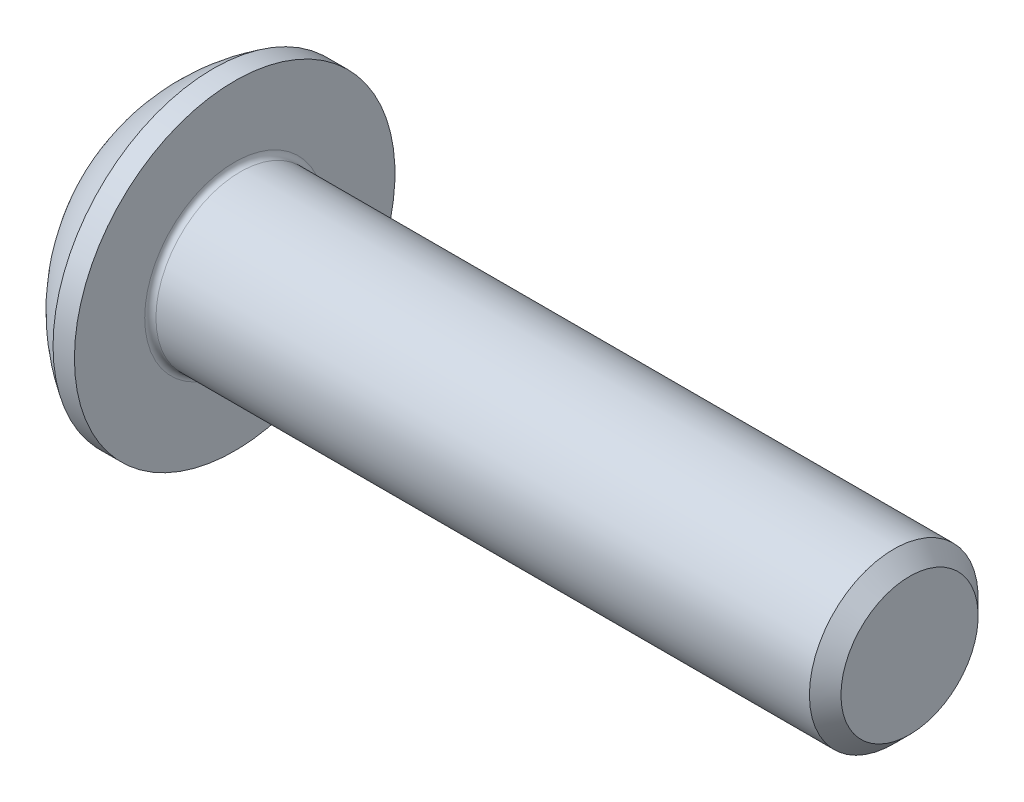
SolidWorks part; units mm, degrees
ref_plane "Plane1" through (0, 0, 0) normal (0, 0, 1) x (1, 0, 0)
ref_plane "Plane2" through (0, 0, 0) normal (0, 1, 0) x (1, 0, 0)
ref_plane "Plane3" through (0, 0, 0) normal (1, 0, 0) x (0, 0, -1)
other "Configuration Table"
sketch "BodySke" plane through (0, 0, 0) normal (0, 0, 1) x (1, 0, 0)
  line L0 (13.65, 0) -> (13.65, 1.2195)
  line L1 (13.3695, 1.5) -> (1.65, 1.5)
  line L2 (1.65, 1.5) -> (1.65, 2.85)
  line L3 (1.65, 2.85) -> (1.27, 2.85)
  line L4 (0, 0) -> (101.6, 0) construction
  line L5 (1.65, -2.85) -> (1.27, -2.85) construction
  line L6 (55.6768, -1.5) -> (1.65, -1.5) construction
  line L7 (13.65, 0) -> (0, 0)
  line L8 (0, 1.425) -> (0, -1.425) construction
  line L9 (0, 0) -> (0, 1.425)
  line L10 (13.65, 1.2195) -> (13.3695, 1.5)
  line L11 (13.65, -1.2195) -> (13.3695, -1.5) construction
  line L12 (2.15, 9.525) -> (2.15, -1.5) construction
  line L13 (1.65, 9.525) -> (1.65, -1.5) construction
  arc A1 (0, 1.425) -> (1.27, 2.85) centre (3.0334, 0) cw
revolve "BaseBody" add sketch "BodySke" angle 360 about L4
fillet "Fillet1" radius 0.1 1 edges at (1.65, 0, 1.5)
sketch "Sketch2" plane through (0, 0, 0) normal (0, 0, 1) x (1, 0, 0)
  line L0 (0, 1) -> (1.04, 1)
  line L1 (1.04, 1) -> (1.6174, 0)
  line L3 (1.6174, 0) -> (0, 0)
  line L4 (0, 0) -> (0, 1)
  line L5 (0, -1) -> (1.04, -1) construction
  line L6 (0, 0) -> (47.625, 0) construction
  dimension "D2" = 60
  dimension "PreBroach_depth" = 1.04
  dimension "PreBroach_dia" = 2
revolve "PreBroach" cut sketch "Sketch2" angle 360 about L6
sketch "Sketch3" plane through (0, 0, 0) normal (1, 0, 0) x (0, 0, -1)
  line L0 (-1, -0.5774) -> (-1, 0.5774)
  line L1 (-1, 0.5774) -> (0, 1.1547)
  line L2 (0, 1.1547) -> (1, 0.5774)
  line L3 (1, 0.5774) -> (1, -0.5774)
  line L4 (1, -0.5774) -> (0, -1.1547)
  line L5 (0, -1.1547) -> (-1, -0.5774)
extrude "Hex" cut sketch "Sketch3" along normal blind 1.04
sketch "ThdSchSke" plane through (0, 0, 0) normal (0, 0, 1) x (1, 0, 0)
  line L0 (2.65, -1.2195) -> (2.4536, -1.5)
  line L1 (2.65, -1.2195) -> (2.8464, -1.5)
  line L2 (2.8464, -1.5) -> (2.8464, -1.875)
  line L3 (-3.175, 0) -> (5.1513, 0) construction
  line L5 (2.8464, -1.875) -> (2.4536, -1.875)
  line L6 (2.4536, -1.875) -> (2.4536, -1.5)
revolve "ThreadSchematic" [suppressed] cut sketch "ThdSchSke" angle 360 about L3
pattern_linear "ThdSchPat" [suppressed]
equation "\"D1@BodySke\" = \"Head_dia@BodySke\" * .5"
equation "\"Thread_minor@ThreadCosmetic\" = \"Minor_dia@BodySke\""
equation "\"D1@Sketch3\" = \"Hex_size@Sketch3\" / 2"
equation "\"D2@Sketch3\" = \"D1@Sketch3\""
equation "\"D3@Sketch3\" = \"Hex_size@Sketch3\""
equation "\"Thread_length@ThreadCosmetic\" = ((sgn( (\"Length@BodySke\" - \"Advance@BodySke\" * 2.0) - \"Thread_nom@BodySke\" )-1)*( (\"Length@BodySke\" - \"Advance@BodySke\" * 2.0) - \"Thread_nom@BodySke\" ))/-2+ \"Thread_no"
equation "\"Thread_minor@ThdSchSke\" = \"Minor_dia@BodySke\""
equation "\"Diameter@ThdSchSke\" = \"Diameter@BodySke\""
equation "\"Overcut@ThdSchSke\" = \"Diameter@BodySke\" * 1.25"
equation "\"Start@ThdSchSke\" = \"Head_ht@BodySke\" + \"Length@BodySke\" - \"Thread_length@ThreadCosmetic\"  '---Non-countersunk---"
equation "\"Num_threads@ThdSchPat\" = int( \"Thread_length@ThreadCosmetic\" / \"Advance@BodySke\" + 0.999 )  + 1"
equation "\"Advance@ThdSchPat\" = \"Thread_length@ThreadCosmetic\" /  (\"Num_threads@ThdSchPat\" - 1) 'relax it"
equation "\"Num_threads@ThdSchPat\" = \"Num_threads@ThdSchPat\" - sgn( \"Num_threads@ThdSchPat\" - 1) '---chamfered tips only---"
